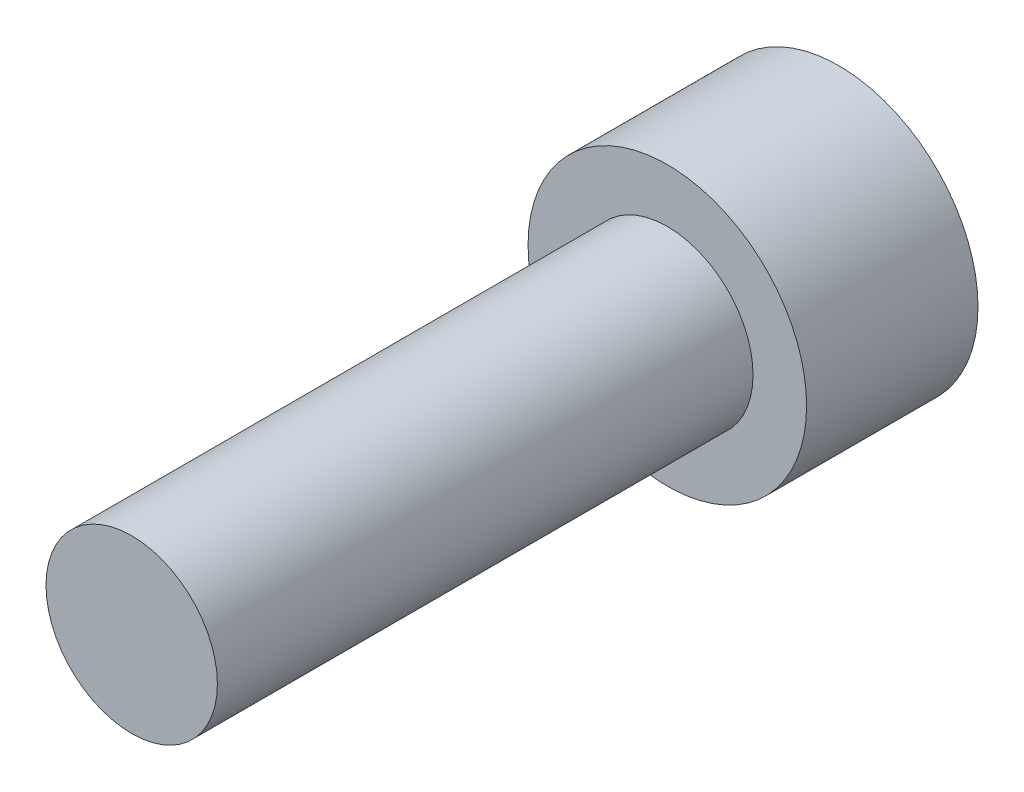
SolidWorks part; units mm, degrees
ref_plane "前视基准面" through (0, 0, 0) normal (0, 0, 1) x (1, 0, 0)
ref_plane "上视基准面" through (0, 0, 0) normal (0, 1, 0) x (1, 0, 0)
ref_plane "右视基准面" through (0, 0, 0) normal (1, 0, 0) x (0, 0, -1)
sketch "草图1" plane through (0, 0, 0) normal (0, 0, 1) x (1, 0, 0)
  circle A0 centre (0, 0) radius 6.5
extrude "凸台-拉伸1" add sketch "草图1" along normal blind 8
sketch "草图2" plane through (0, 0, 8) normal (0, 0, 1) x (1, 0, 0)
  circle A0 centre (0, 0) radius 4
extrude "凸台-拉伸2" add sketch "草图2" along normal blind 25
sketch "草图3" plane through (0, 0, 0) normal (0, 0, -1) x (-1, 0, 0)
  line L1 (3.2517, 3.2802) -> (-1.2149, 4.4561)
  line L2 (-1.2149, 4.4561) -> (-4.4666, 1.1759)
  line L3 (-4.4666, 1.1759) -> (-3.2517, -3.2802)
  line L4 (-3.2517, -3.2802) -> (1.2149, -4.4561)
  line L5 (1.2149, -4.4561) -> (4.4666, -1.1759)
  line L6 (4.4666, -1.1759) -> (3.2517, 3.2802)
  circle A0 centre (0, 0) radius 4 construction
  dimension "D1" = 8
extrude "切除-拉伸1" cut sketch "草图3" against normal blind 7.5
